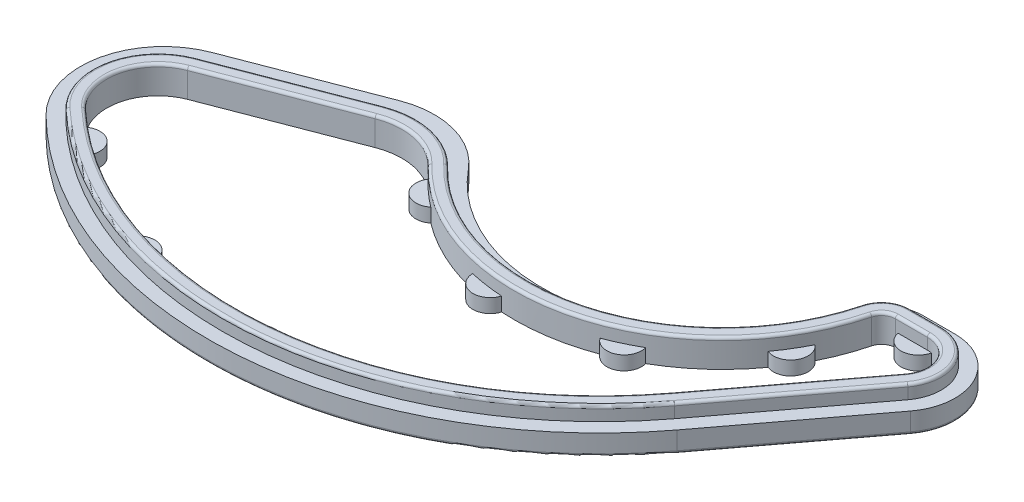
SolidWorks part; units mm, degrees
ref_plane "Front Plane" through (0, 0, 0) normal (0, 0, 1) x (1, 0, 0)
ref_plane "Top Plane" through (0, 0, 0) normal (0, 1, 0) x (1, 0, 0)
ref_plane "Right Plane" through (0, 0, 0) normal (1, 0, 0) x (0, 0, -1)
sketch "Schizzo28" plane through (0, 0, 9.5) normal (0, -1, 0) x (1, 0, 0)
  line L0 (-17.8027, -10.2118) -> (-8.0304, -6.4606)
  line L1 (0, 0) -> (22.5615, -17.0013) construction
  line L2 (22.5615, -17.0013) -> (29.7911, -7.4073)
  line L3 (26.5965, -1) -> (24.2919, -1)
  line L4 (-16.7276, -13.0126) -> (-6.9553, -9.2613)
  line L5 (26.5965, -4) -> (24.2919, -4)
  line L6 (20.1655, -15.1958) -> (27.3952, -5.6018)
  line L7 (0, 0) -> (8.8, 0) construction
  line L8 (-8.0304, -6.4606) -> (8.8, 0) construction
  line L9 (0, 0) -> (0, 5.6175) construction
  arc A0 (-1.2443, -8.253) -> (21.3872, -3.25) centre (8.8, 0) ccw
  arc A1 (-19.8734, -20.0776) -> (22.5615, -17.0013) centre (0, 0) ccw
  arc A2 (-1.2443, -8.253) -> (21.3872, -3.25) centre (8.8, 0) ccw construction
  arc A4 (-17.8027, -10.2118) -> (-19.8734, -20.0776) centre (-15.6525, -15.8133) ccw
  arc A5 (-1.2443, -8.253) -> (-8.0304, -6.4606) centre (-5.8802, -12.0621) ccw
  arc A6 (24.2919, -1) -> (21.3872, -3.25) centre (24.2919, -4) ccw
  arc A7 (29.7911, -7.4073) -> (26.5965, -1) centre (26.5965, -5) ccw
  arc A8 (-3.5622, -10.1575) -> (-6.9553, -9.2613) centre (-5.8802, -12.0621) ccw
  arc A9 (-3.5622, -10.1575) -> (24.2919, -4) centre (8.8, 0) ccw
  arc A10 (24.2919, -4) -> (24.2919, -4) centre (24.2919, -4) ccw
  arc A11 (27.3952, -5.6018) -> (26.5965, -4) centre (26.5965, -5) ccw
  arc A12 (-17.763, -17.9454) -> (20.1655, -15.1958) centre (0, 0) ccw
  arc A13 (-16.7276, -13.0126) -> (-17.763, -17.9454) centre (-15.6525, -15.8133) ccw
  dimension "D2" = 13
  dimension "D3" = 6
  dimension "D4" = 6
  dimension "D5" = 3
  dimension "D6" = 4
  dimension "D12" = 28.25
  dimension "D8" = 1
  dimension "D9" = 8.8
  dimension "D10" = 21
  dimension "D11" = 37
  dimension "D7" = 3
sketch "Schizzo30" plane through (0, 0, 0) normal (0, 1, 0) x (1, 0, 0)
  line L6 (-17.8027, 0.7118) -> (-8.0304, -3.0394)
  line L7 (24.2919, -8.5) -> (26.5965, -8.5)
  line L8 (29.7911, -2.0927) -> (22.5615, 7.5013)
  line L9 (-17.8027, 0.7118) -> (-8.0304, -3.0394)
  line L10 (24.2919, -8.5) -> (26.5965, -8.5)
  line L11 (29.7911, -2.0927) -> (22.5615, 7.5013)
  arc A12 (-8.0304, -3.0394) -> (-1.2443, -1.247) centre (-5.8802, 2.5621) ccw
  arc A13 (21.3872, -6.25) -> (-1.2443, -1.247) centre (8.8, -9.5) ccw
  arc A14 (21.3872, -6.25) -> (24.2919, -8.5) centre (24.2919, -5.5) ccw
  arc A15 (26.5965, -8.5) -> (29.7911, -2.0927) centre (26.5965, -4.5) ccw
  arc A16 (22.5615, 7.5013) -> (-19.8734, 10.5776) centre (0, -9.5) ccw
  arc A17 (-19.8734, 10.5776) -> (-17.8027, 0.7118) centre (-15.6525, 6.3133) ccw
  arc A18 (-8.0304, -3.0394) -> (-1.2443, -1.247) centre (-5.8802, 2.5621) ccw
  arc A19 (21.3872, -6.25) -> (-1.2443, -1.247) centre (8.8, -9.5) ccw
  arc A20 (21.3872, -6.25) -> (24.2919, -8.5) centre (24.2919, -5.5) ccw
  arc A21 (26.5965, -8.5) -> (29.7911, -2.0927) centre (26.5965, -4.5) ccw
  arc A22 (22.5615, 7.5013) -> (-19.8734, 10.5776) centre (0, -9.5) ccw
  arc A23 (-19.8734, 10.5776) -> (-17.8027, 0.7118) centre (-15.6525, 6.3133) ccw
  dimension "D1" = 0
extrude "Estrusione-Estrusione1" add sketch "Schizzo30" along normal blind 1
sketch "Schizzo31" plane through (0, 0, 0) normal (0, 1, 0) x (1, 0, 0)
  line L16 (-16.7276, 3.5126) -> (-6.9553, -0.2387)
  line L19 (-17.086, 2.579) -> (-7.3136, -1.1723)
  line L20 (24.2919, -6.5) -> (26.5965, -6.5)
  line L21 (28.1938, -3.2964) -> (20.9642, 6.2976)
  line L23 (24.2919, -6.5) -> (26.5965, -6.5)
  line L24 (28.1938, -3.2964) -> (20.9642, 6.2976)
  arc A0 (-16.7276, 3.5126) -> (-17.9296, 9.6727) centre (-15.4009, 6.9688) cw
  arc A1 (-6.9553, -0.2387) -> (-2.0443, 0.8635) centre (-5.3277, 4.0013) ccw
  arc A39 (-7.3136, -1.1723) -> (-2.7896, 0.0227) centre (-5.8802, 2.5621) ccw
  arc A40 (23.3237, -5.75) -> (-2.7896, 0.0227) centre (8.8, -9.5) ccw
  arc A41 (23.3237, -5.75) -> (24.2919, -6.5) centre (24.2919, -5.5) ccw
  arc A42 (26.5965, -6.5) -> (28.1938, -3.2964) centre (26.5965, -4.5) ccw
  arc A43 (20.9642, 6.2976) -> (-18.4665, 9.1562) centre (0, -9.5) ccw
  arc A44 (-18.4665, 9.1562) -> (-17.086, 2.579) centre (-15.6525, 6.3133) ccw
  arc A46 (23.3237, -5.75) -> (-2.0443, 0.8635) centre (8.8, -9.5) ccw
  arc A47 (23.3237, -5.75) -> (24.2919, -6.5) centre (24.2919, -5.5) ccw
  arc A48 (26.5965, -6.5) -> (28.1938, -3.2964) centre (26.5965, -4.5) ccw
  arc A49 (20.9642, 6.2976) -> (-17.9296, 9.6727) centre (0, -9.5) ccw
  dimension "D1" = 2
extrude "Taglio-Estrusione2" cut sketch "Schizzo31" along normal through all
sketch "Schizzo32" plane through (0, 0, 0) normal (0, 1, 0) x (1, 0, 0)
  line L0 (26.5965, -5.5) -> (24.2919, -5.5) construction
  line L1 (20.1655, 5.6958) -> (27.3952, -3.8982) construction
  line L2 (-1.0266, 1.5) -> (6.6752, 5.0962) construction
  line L3 (6.6752, 5.0962) -> (15.0826, 3.8451) construction
  line L4 (15.0826, 3.8451) -> (21.4037, -1.8377) construction
  line L5 (-16.9013, 10.9107) -> (-8.1341, 15.7208) construction
  line L6 (-8.1341, 15.7208) -> (1.7914, 16.9394) construction
  line L7 (1.7914, 16.9394) -> (11.4618, 14.393) construction
  line L8 (11.4618, 14.393) -> (19.5, 8.4444) construction
  line L9 (0, -9.5) -> (8.8, -9.5) construction
  circle A0 centre (-1.0266, 1.5) radius 1.25
  arc A1 (24.2919, -5.5) -> (-3.5622, 0.6575) centre (8.8, -9.5) ccw construction
  circle A2 centre (6.6752, 5.0962) radius 1.25
  circle A3 centre (15.0826, 3.8451) radius 1.25
  circle A4 centre (21.4037, -1.8377) radius 1.25
  circle A5 centre (25.7, -6.75) radius 1.25
  circle A6 centre (25.7, 0.4284) radius 1.25
  circle A7 centre (19.5, 8.4444) radius 1.25
  circle A8 centre (11.4618, 14.393) radius 1.25
  circle A9 centre (1.7914, 16.9394) radius 1.25
  circle A10 centre (-8.1341, 15.7208) radius 1.25
  circle A11 centre (-16.9013, 10.9107) radius 1.25
  arc A12 (20.1655, 5.6958) -> (-17.763, 8.4454) centre (0, -9.5) ccw construction
  dimension "D1" = 2.5
  dimension "D2" = 2.5
  dimension "D3" = 2.5
  dimension "D4" = 2.5
  dimension "D5" = 2.5
  dimension "D6" = 2.5
  dimension "D7" = 2.5
  dimension "D8" = 2.5
  dimension "D9" = 2.5
  dimension "D10" = 2.5
  dimension "D11" = 2.5
  dimension "D12" = 8.5
  dimension "D13" = 8.5
  dimension "D14" = 8.5
  dimension "D15" = 10
  dimension "D16" = 10
  dimension "D17" = 10
  dimension "D18" = 10
  dimension "D19" = 11
  dimension "D20" = 25.7
  dimension "D21" = 25.7
  dimension "D22" = 19.5
extrude "Estrusione-Estrusione2" add sketch "Schizzo32" along normal blind 1
sketch "Schizzo33" plane through (0, 0, 0) normal (0, 1, 0) x (1, 0, 0)
  line L22 (24.2919, -7.5) -> (26.5965, -7.5)
  line L23 (28.9924, -2.6946) -> (21.7628, 6.8995)
  line L24 (-17.4444, 1.6454) -> (-7.672, -2.1058)
  line L25 (24.2919, -7.5) -> (26.5965, -7.5)
  line L26 (28.9924, -2.6946) -> (21.7628, 6.8995)
  line L27 (-17.4444, 1.6454) -> (-7.672, -2.1058)
  line L47 (24.2919, -8.5) -> (26.5965, -8.5)
  line L48 (29.7911, -2.0927) -> (22.5615, 7.5013)
  line L49 (-17.8027, 0.7118) -> (-8.0304, -3.0394)
  line L50 (24.2919, -8.5) -> (26.5965, -8.5)
  line L51 (29.7911, -2.0927) -> (22.5615, 7.5013)
  line L52 (-17.8027, 0.7118) -> (-8.0304, -3.0394)
  arc A32 (-7.672, -2.1058) -> (-2.017, -0.6122) centre (-5.8802, 2.5621) ccw
  arc A33 (22.3554, -6) -> (-2.017, -0.6122) centre (8.8, -9.5) ccw
  arc A34 (22.3554, -6) -> (24.2919, -7.5) centre (24.2919, -5.5) ccw
  arc A35 (26.5965, -7.5) -> (28.9924, -2.6946) centre (26.5965, -4.5) ccw
  arc A36 (21.7628, 6.8995) -> (-19.1699, 9.8669) centre (0, -9.5) ccw
  arc A37 (-19.1699, 9.8669) -> (-17.4444, 1.6454) centre (-15.6525, 6.3133) ccw
  arc A38 (-7.672, -2.1058) -> (-2.017, -0.6122) centre (-5.8802, 2.5621) ccw
  arc A39 (22.3554, -6) -> (-2.017, -0.6122) centre (8.8, -9.5) ccw
  arc A40 (22.3554, -6) -> (24.2919, -7.5) centre (24.2919, -5.5) ccw
  arc A41 (26.5965, -7.5) -> (28.9924, -2.6946) centre (26.5965, -4.5) ccw
  arc A42 (21.7628, 6.8995) -> (-19.1699, 9.8669) centre (0, -9.5) ccw
  arc A43 (-19.1699, 9.8669) -> (-17.4444, 1.6454) centre (-15.6525, 6.3133) ccw
  arc A70 (-8.0304, -3.0394) -> (-1.2443, -1.247) centre (-5.8802, 2.5621) ccw
  arc A71 (21.3872, -6.25) -> (-1.2443, -1.247) centre (8.8, -9.5) ccw
  arc A72 (21.3872, -6.25) -> (24.2919, -8.5) centre (24.2919, -5.5) ccw
  arc A73 (26.5965, -8.5) -> (29.7911, -2.0927) centre (26.5965, -4.5) ccw
  arc A74 (22.5615, 7.5013) -> (-19.8734, 10.5776) centre (0, -9.5) ccw
  arc A75 (-19.8734, 10.5776) -> (-17.8027, 0.7118) centre (-15.6525, 6.3133) ccw
  arc A76 (-8.0304, -3.0394) -> (-1.2443, -1.247) centre (-5.8802, 2.5621) ccw
  arc A77 (21.3872, -6.25) -> (-1.2443, -1.247) centre (8.8, -9.5) ccw
  arc A78 (21.3872, -6.25) -> (24.2919, -8.5) centre (24.2919, -5.5) ccw
  arc A79 (26.5965, -8.5) -> (29.7911, -2.0927) centre (26.5965, -4.5) ccw
  arc A80 (22.5615, 7.5013) -> (-19.8734, 10.5776) centre (0, -9.5) ccw
  arc A81 (-19.8734, 10.5776) -> (-17.8027, 0.7118) centre (-15.6525, 6.3133) ccw
  dimension "D1" = 1
  dimension "D2" = 0
extrude "Estrusione-Estrusione3" add sketch "Schizzo33" against normal blind 0.5
sketch "Schizzo34" plane through (0, 0, 0) normal (0, 1, 0) x (1, 0, 0)
  line L19 (24.2919, -7.5) -> (26.5965, -7.5)
  line L20 (28.9924, -2.6946) -> (21.7628, 6.8995)
  line L21 (-17.086, 2.579) -> (-7.3136, -1.1723)
  line L22 (24.2919, -7.5) -> (26.5965, -7.5)
  line L23 (28.9924, -2.6946) -> (21.7628, 6.8995)
  line L24 (-17.086, 2.579) -> (-7.3136, -1.1723)
  line L41 (24.2919, -6.5) -> (26.5965, -6.5)
  line L42 (28.1938, -3.2964) -> (20.9642, 6.2976)
  line L43 (-16.7276, 3.5126) -> (-6.9553, -0.2387)
  line L44 (24.2919, -6.5) -> (26.5965, -6.5)
  line L45 (28.1938, -3.2964) -> (20.9642, 6.2976)
  line L46 (-16.7276, 3.5126) -> (-6.9553, -0.2387)
  arc A35 (22.3554, -6) -> (-1.3213, 0.1726) centre (8.8, -9.5) ccw
  arc A36 (22.3554, -6) -> (24.2919, -7.5) centre (24.2919, -5.5) ccw
  arc A37 (26.5965, -7.5) -> (28.9924, -2.6946) centre (26.5965, -4.5) ccw
  arc A38 (21.7628, 6.8995) -> (-18.6126, 10.4031) centre (0, -9.5) ccw
  arc A39 (-7.3136, -1.1723) -> (-1.3213, 0.1726) centre (-5.3277, 4.0013) ccw
  arc A40 (-18.6126, 10.4031) -> (-17.086, 2.579) centre (-15.4009, 6.9688) ccw
  arc A41 (22.3554, -6) -> (-1.3213, 0.1726) centre (8.8, -9.5) ccw
  arc A42 (22.3554, -6) -> (24.2919, -7.5) centre (24.2919, -5.5) ccw
  arc A43 (26.5965, -7.5) -> (28.9924, -2.6946) centre (26.5965, -4.5) ccw
  arc A44 (21.7628, 6.8995) -> (-18.6126, 10.4031) centre (0, -9.5) ccw
  arc A45 (-7.3136, -1.1723) -> (-1.3213, 0.1726) centre (-5.3277, 4.0013) ccw
  arc A46 (-18.6126, 10.4031) -> (-17.086, 2.579) centre (-15.4009, 6.9688) ccw
  arc A76 (23.3237, -5.75) -> (-2.0443, 0.8635) centre (8.8, -9.5) ccw
  arc A77 (23.3237, -5.75) -> (24.2919, -6.5) centre (24.2919, -5.5) ccw
  arc A78 (26.5965, -6.5) -> (28.1938, -3.2964) centre (26.5965, -4.5) ccw
  arc A79 (20.9642, 6.2976) -> (-17.9296, 9.6727) centre (0, -9.5) ccw
  arc A80 (-17.9296, 9.6727) -> (-16.7276, 3.5126) centre (-15.4009, 6.9688) ccw
  arc A81 (-6.9553, -0.2387) -> (-2.0443, 0.8635) centre (-5.3277, 4.0013) ccw
  arc A82 (23.3237, -5.75) -> (-2.0443, 0.8635) centre (8.8, -9.5) ccw
  arc A83 (23.3237, -5.75) -> (24.2919, -6.5) centre (24.2919, -5.5) ccw
  arc A84 (26.5965, -6.5) -> (28.1938, -3.2964) centre (26.5965, -4.5) ccw
  arc A85 (20.9642, 6.2976) -> (-17.9296, 9.6727) centre (0, -9.5) ccw
  arc A86 (-17.9296, 9.6727) -> (-16.7276, 3.5126) centre (-15.4009, 6.9688) ccw
  arc A87 (-6.9553, -0.2387) -> (-2.0443, 0.8635) centre (-5.3277, 4.0013) ccw
  dimension "D1" = 1
  dimension "D2" = 0
extrude "Estrusione-Estrusione4" add sketch "Schizzo34" along normal blind 2
fillet "Raccordo1" radius 0.2 18 edges at (-21.5246, -0.5, -5.0808) (2.0426, -0.5, -18.6761) (26.1763, -0.5, -2.7043) (30.1763, -0.5, 6.2848) (25.4442, -0.5, 8.5) (22.4548, -0.5, 7.8717) (11.6061, -0.5, -3.1935) (-4.3479, -0.5, 3.239) (-20.5459, -0.5, -5.2863) (1.9703, -0.5, -17.6787) (25.3776, -0.5, -2.1025) (29.2813, -0.5, 5.8386) (25.4442, -0.5, 7.5) (23.0672, -0.5, 7.0811) (11.8219, -0.5, -4.17) (-4.6033, -0.5, 2.2722) (-12.9165, -0.5, 1.1638) (-12.5582, -0.5, 0.2302)
fillet "Raccordo2" radius 0.2 18 edges at (24.579, 2, -1.5006) (28.3864, 2, 5.3924) (25.4442, 2, 6.5) (23.6796, 2, 6.2906) (12.5841, 2, -5.0149) (-4.3331, 2, 0.4301) (-11.8414, 2, -1.6369) (-19.0345, 2, -6.2598) (25.3776, 2, -2.1025) (29.2813, 2, 5.8386) (25.4442, 2, 7.5) (23.0672, 2, 7.0811) (12.3318, 2, -4.0472) (-4.1141, 2, 1.4058) (-12.1998, 2, -0.7034) (-20.016, 2, -6.0683) (2.2694, 2, -16.6517) (2.3558, 2, -17.648)
ref_plane "Piano di specchio" through (0, 0, 9.5) normal (0, 0, 1) x (1, 0, 0)
mirror "Specchia7" about plane through (0, 0, 9.5) normal (0, 0, 1)
delete or keep bodies "Corpo-Elimina/Mantieni 2" type delete bodies bodies 157
